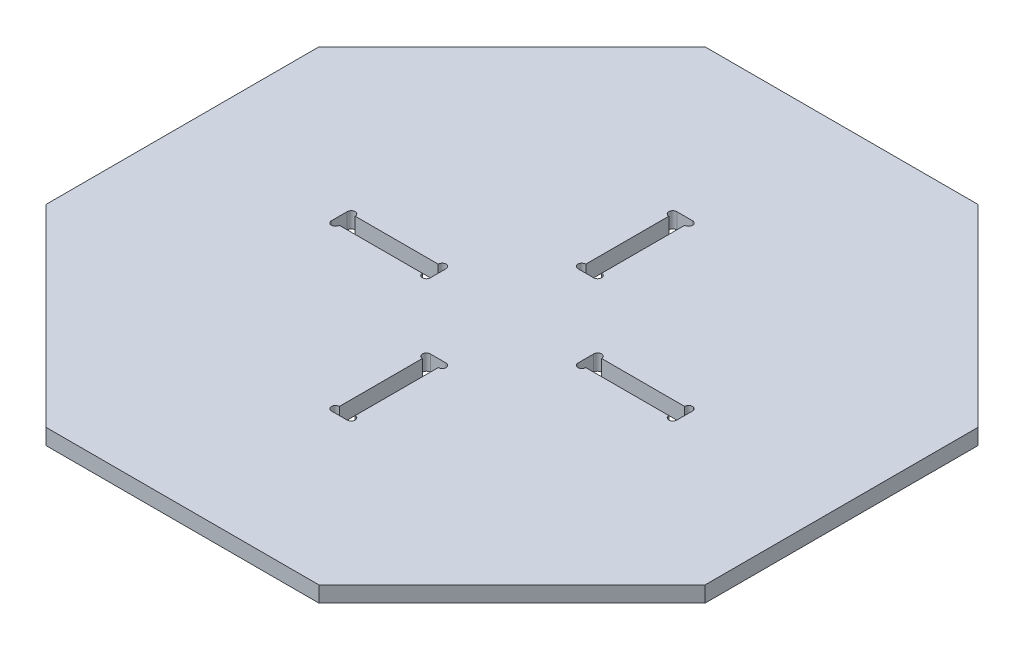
SolidWorks part; units mm, degrees
ref_plane "Front" through (0, 0, 0) normal (0, 0, 1) x (1, 0, 0)
ref_plane "Top" through (0, 0, 0) normal (0, 1, 0) x (1, 0, 0)
ref_plane "Right" through (0, 0, 0) normal (1, 0, 0) x (0, 0, -1)
sketch "Sketch1" plane through (0, 0, 0) normal (0, 1, 0) x (1, 0, 0)
  line L6 (-250, -103.5534) -> (-103.5534, -250)
  line L7 (103.5534, -250) -> (250, -103.5534)
  line L8 (250, -103.5534) -> (250, 103.5534)
  line L9 (250, 103.5534) -> (103.5534, 250)
  line L10 (103.5534, 250) -> (-103.5534, 250)
  line L11 (-103.5534, 250) -> (-250, 103.5534)
  line L12 (-250, 103.5534) -> (-250, -103.5534)
  line L13 (-103.5534, -250) -> (103.5534, -250)
  circle A0 centre (0, 0) radius 250 construction
  line B0 (-209.7123, 0) -> (193.9305, 0) construction
  line B1 (0, -248.4366) -> (0, 217.3907) construction
  arc B2 (-6, 125) -> (-6, 131) centre (-6, 128) cw
  line B3 (56, -6) -> (56, 6)
  line B4 (62, -6) -> (125, -6)
  line B5 (131, -6) -> (131, 6)
  line B6 (62, 6) -> (125, 6)
  arc B7 (-56, -6) -> (-62, -6) centre (-59, -6) cw
  line B8 (-6, -131) -> (6, -131)
  line B9 (6, -62) -> (6, -125)
  line B10 (-6, -56) -> (6, -56)
  line B11 (-6, -62) -> (-6, -125)
  line B12 (-62, 6) -> (-125, 6)
  line B13 (-131, -6) -> (-131, 6)
  line B14 (-62, -6) -> (-125, -6)
  line B15 (-56, -6) -> (-56, 6)
  line B16 (-6, 62) -> (-6, 125)
  line B17 (-6, 56) -> (6, 56)
  line B18 (6, 62) -> (6, 125)
  line B19 (-6, 131) -> (6, 131)
  arc B20 (131, 6) -> (125, 6) centre (128, 6) ccw
  arc B21 (125, -6) -> (131, -6) centre (128, -6) ccw
  arc B22 (62, 6) -> (56, 6) centre (59, 6) ccw
  arc B23 (56, -6) -> (62, -6) centre (59, -6) ccw
  arc B24 (-62, 6) -> (-56, 6) centre (-59, 6) cw
  arc B25 (-125, -6) -> (-131, -6) centre (-128, -6) cw
  arc B26 (-131, 6) -> (-125, 6) centre (-128, 6) cw
  arc B27 (6, -62) -> (6, -56) centre (6, -59) ccw
  arc B28 (-6, -56) -> (-6, -62) centre (-6, -59) ccw
  arc B29 (6, -131) -> (6, -125) centre (6, -128) ccw
  arc B30 (-6, -125) -> (-6, -131) centre (-6, -128) ccw
  arc B31 (6, 131) -> (6, 125) centre (6, 128) cw
  arc B32 (-6, 56) -> (-6, 62) centre (-6, 59) cw
  arc B33 (6, 62) -> (6, 56) centre (6, 59) cw
  dimension "D1" = 500
sketch_block_instance "Block1-1"
sketch_block "Block1" parameters "D5"=10.3154, "D6"=11.861, "D1"=75, "D2"=12, "D3"=56, "D4"=56, "D7"=12
extrude "Boss-Extrude1" add sketch "Sketch1" along normal blind 12
